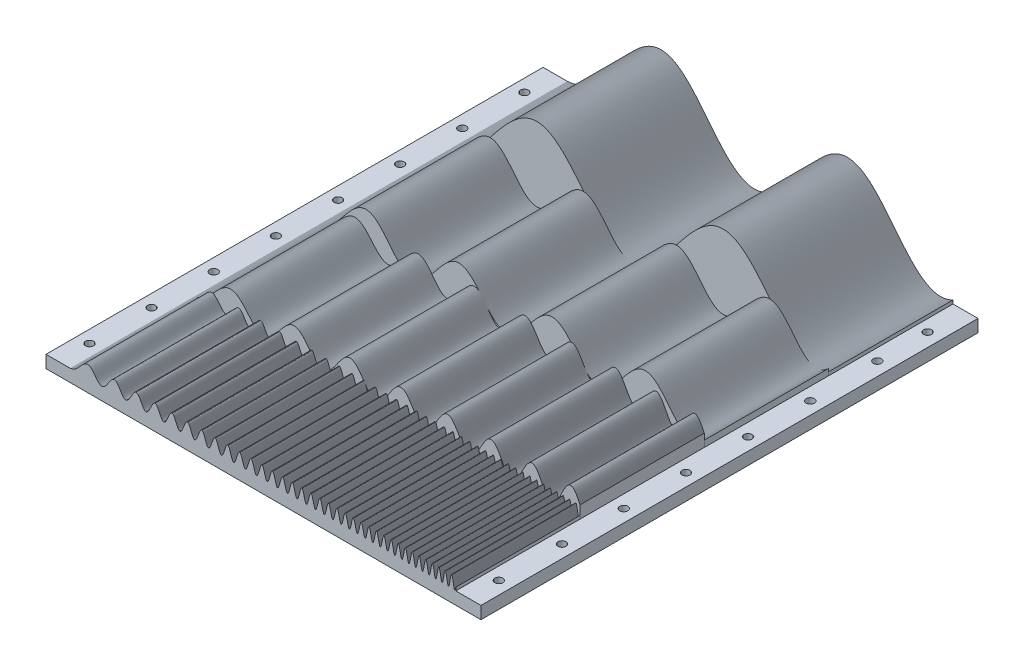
SolidWorks part; units mm, degrees
ref_plane "Front Plane" through (0, 0, 0) normal (0, 0, 1) x (1, 0, 0)
ref_plane "Top Plane" through (0, 0, 0) normal (0, 1, 0) x (1, 0, 0)
ref_plane "Right Plane" through (0, 0, 0) normal (1, 0, 0) x (0, 0, -1)
imported_body "sineRow1-1-solid1"
imported_body "sineRow2-1-solid1"
imported_body "sineRow3-1-solid1"
imported_body "sineRow4-1-solid1"
combine bodies "Combine1" operation type add bodies to combine 101 102 103 104
